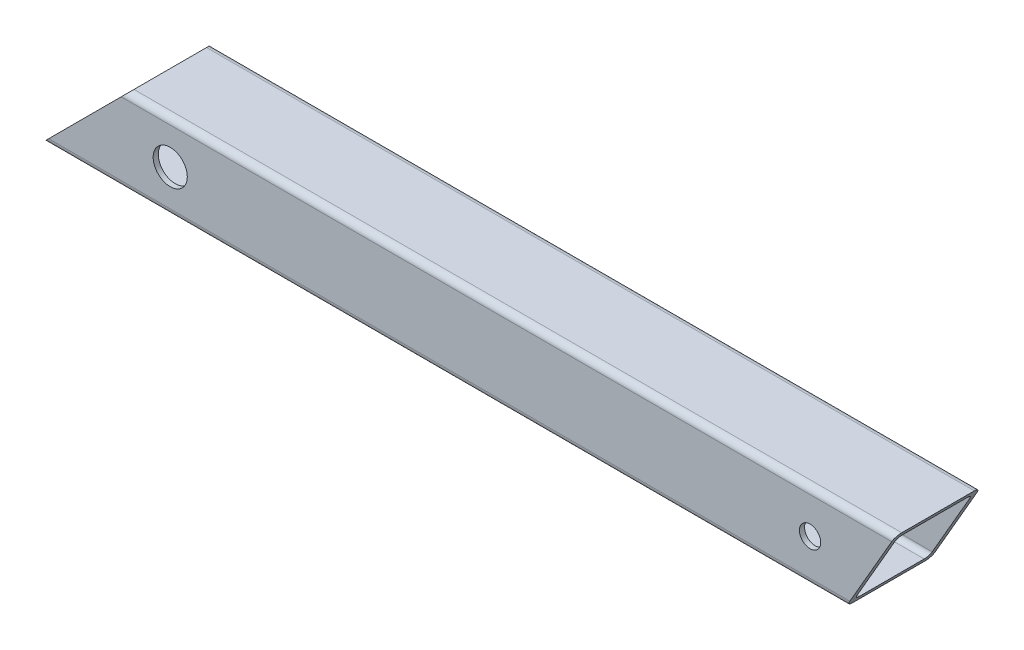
SolidWorks part; units mm, degrees
ref_plane "Front Plane" through (0, 0, 0) normal (0, 0, 1) x (1, 0, 0)
ref_plane "Top Plane" through (0, 0, 0) normal (0, 1, 0) x (1, 0, 0)
ref_plane "Right Plane" through (0, 0, 0) normal (1, 0, 0) x (0, 0, -1)
sketch "Member Sketch" plane through (0, 0, 0) normal (0, 1, 0) x (1, 0, 0)
  line L0 (0, 0) -> (1000, 0)
  line L2 (0, 0) -> (1000, 0) construction
other "Structural Member1"
ref_plane "Plane1" through (0, 0, 0) normal (1, 0, 0) x (0, 0, -1)
sketch "Sketch1" plane through (0, 0, 0) normal (1, 0, 0) x (0, 0, -1)
  line L0 (0, 50) -> (0, -50) construction
  line L1 (-50, 0) -> (50, 0) construction
  line L2 (-42.5, 50) -> (42.5, 50)
  line L3 (50, 42.5) -> (50, -42.5)
  line L4 (-50, 42.5) -> (-50, -42.5)
  line L5 (-42.5, -50) -> (42.5, -50)
  line L6 (-38, 44) -> (38, 44)
  line L7 (44, 38) -> (44, -38)
  line L8 (-38, -44) -> (38, -44)
  line L9 (-44, 38) -> (-44, -38)
  arc A0 (42.5, 50) -> (50, 42.5) centre (42.5, 42.5) cw
  arc A1 (-42.5, 50) -> (-50, 42.5) centre (-42.5, 42.5) ccw
  arc A2 (-42.5, -50) -> (-50, -42.5) centre (-42.5, -42.5) cw
  arc A3 (42.5, -50) -> (50, -42.5) centre (42.5, -42.5) ccw
  arc A4 (38, 44) -> (44, 38) centre (38, 38) cw
  arc A5 (44, -38) -> (38, -44) centre (38, -38) cw
  arc A6 (-38, -44) -> (-44, -38) centre (-38, -38) cw
  arc A7 (-44, 38) -> (-38, 44) centre (-38, 38) cw
  point P28 (0, 0)
  point P29 (-50, 50)
  point P30 (50, 50)
  point P31 (50, -50)
  point P32 (-50, -50)
  dimension "RADIUS" = 7.5
  dimension "InsideR" = 6
  dimension "WIDTH" = 100
  dimension "HEIGHT" = 100
  dimension "WALL THK" = 6
sketch "Sketch13" plane through (0, 0, 0) normal (0, 0, 1) x (1, 0, 0)
  line L0 (0, -50) -> (100, 50)
  line L1 (1000, 50) -> (0, 50) construction
  line L4 (0, 42.5) -> (0, -42.5) construction
  dimension "D1" = 45
extrude "Cut-Extrude2" cut sketch "Sketch13" against normal through all and the other way through all
sketch "Sketch14" plane through (0, 0, 0) normal (0, 0, 1) x (1, 0, 0)
  line L0 (1000, 50) -> (942.265, -50)
  line L1 (1000, -50) -> (0, -50) construction
  line L2 (1000, 42.5) -> (1000, -42.5) construction
  dimension "D1" = 30
extrude "Cut-Extrude5" cut sketch "Sketch14" against normal through all and the other way through all
sketch "Sketch15" plane through (0, 0, 50) normal (0, 0, 1) x (1, 0, 0)
  line L0 (0, 0) -> (1000, 0) construction
  circle A0 centre (150, 0) radius 20
  circle A1 centre (900, 0) radius 12.5
  dimension "D1" = 40
  dimension "D2" = 25
  dimension "D3" = 100
  dimension "D4" = 150
extrude "Cut-Extrude6" cut sketch "Sketch15" against normal through all
